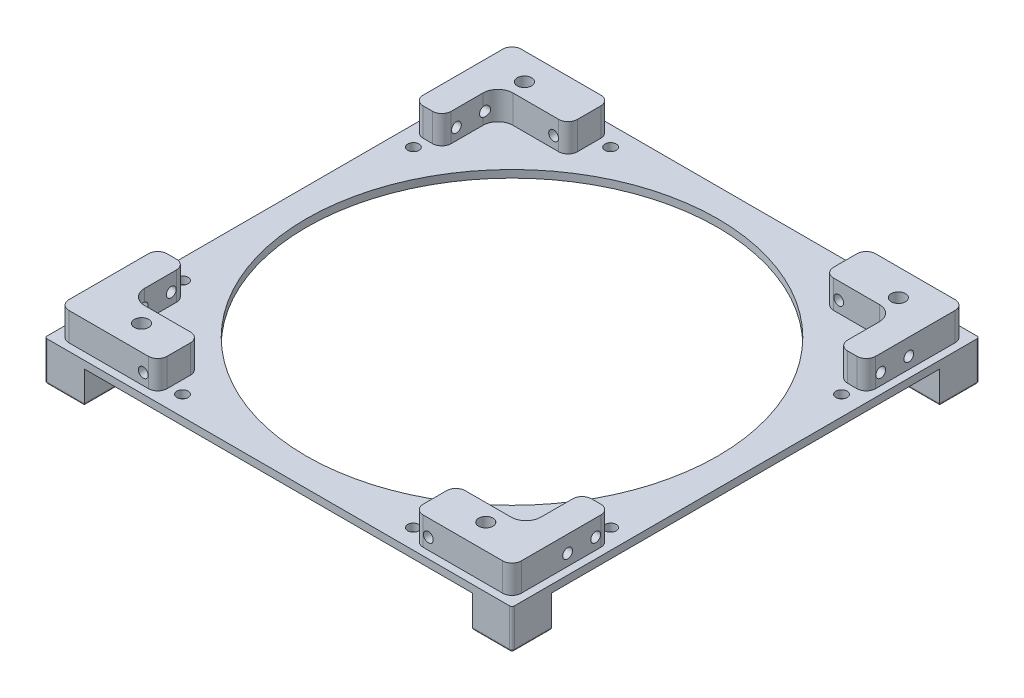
SolidWorks part; units mm, degrees
ref_plane "Front Plane" through (0, 0, 0) normal (0, 0, 1) x (1, 0, 0)
ref_plane "Top Plane" through (0, 0, 0) normal (0, 1, 0) x (1, 0, 0)
ref_plane "Right Plane" through (0, 0, 0) normal (1, 0, 0) x (0, 0, -1)
sketch "Sketch2" plane through (0, 0, 0) normal (0, 1, 0) x (1, 0, 0)
  line L1 (-50, 50) -> (50, 50)
  line L2 (-50, 50) -> (-50, -50)
  line L3 (-50, -50) -> (50, -50)
  line L4 (50, 50) -> (50, -50)
  point P4 (0, 50)
  point P6 (-50, 0)
  dimension "D1" = 100
  dimension "D2" = 100
extrude "Boss-Extrude1" add sketch "Sketch2" along normal blind 1.6
sketch "Sketch3" plane through (0, 0, 0) normal (0, 1, 0) x (1, 0, 0)
  line L1 (-50, 50) -> (-41.5, 50)
  line L2 (-50, 50) -> (-50, 41.5)
  line L3 (-50, 41.5) -> (-41.5, 41.5)
  line L4 (-41.5, 50) -> (-41.5, 41.5)
  line L5 (50, 50) -> (41.5, 50)
  line L6 (50, 50) -> (50, 41.5)
  line L7 (50, 41.5) -> (41.5, 41.5)
  line L8 (41.5, 50) -> (41.5, 41.5)
  line L9 (-50, -50) -> (-41.5, -50)
  line L10 (-50, -50) -> (-50, -41.5)
  line L11 (-50, -41.5) -> (-41.5, -41.5)
  line L12 (-41.5, -50) -> (-41.5, -41.5)
  line L13 (50, -50) -> (41.5, -50)
  line L14 (50, -50) -> (50, -41.5)
  line L15 (50, -41.5) -> (41.5, -41.5)
  line L16 (41.5, -50) -> (41.5, -41.5)
  dimension "D1" = 8.5
extrude "Boss-Extrude2" add sketch "Sketch3" against normal blind 6.9
sketch "Sketch4" plane through (0, 0, 0) normal (0, -1, 0) x (1, 0, 0)
  line L0 (27.4, 48.4) -> (48.4, 48.4)
  line L3 (45.4, 45.4) -> (27.4, 45.4)
  line L4 (27.4, 48.4) -> (27.4, 45.4)
  line L7 (48.4, 27.4) -> (45.4, 27.4)
  line L8 (45.4, 45.4) -> (45.4, 27.4)
  line L9 (48.4, 48.4) -> (48.4, 27.4)
  line L10 (50, 41.5) -> (50, -41.5) construction
  line L11 (-41.5, 50) -> (41.5, 50) construction
  line L12 (48.4, -48.4) -> (27.4, -48.4)
  line L13 (48.4, -27.4) -> (45.4, -27.4)
  line L14 (48.4, -27.4) -> (48.4, -48.4)
  line L16 (45.4, -27.4) -> (45.4, -45.4)
  line L19 (45.4, -45.4) -> (27.4, -45.4)
  line L20 (27.4, -48.4) -> (27.4, -45.4)
  line L21 (41.5, -50) -> (-41.5, -50) construction
  dimension "D1" = 21
  dimension "D2" = 3
  dimension "D3" = 1.6
  dimension "D4" = 1.6
  dimension "D5" = 1.6
extrude "Boss-Extrude3" add sketch "Sketch4" against normal blind 7.6
sketch "Sketch51" plane through (0, 0, 0) normal (0, 1, 0) x (1, 0, 0)
  circle A0 centre (0, 0) radius 44
  dimension "D1" = 88
extrude "Cut-Extrude1" cut sketch "Sketch51" along normal up to surface (1.6 mm away)
fillet "Fillet1" radius 2 2 edges at (48.4, 4.6, -48.4) (48.4, 4.6, 48.4)
fillet "Fillet2" radius 0.5 4 edges at (-50, -2.65, 50) (-50, -2.65, -50) (50, -2.65, -50) (50, -2.65, 50)
mirror "Mirror1" about plane through (0, 0, 0) normal (1, 0, 0) of "Boss-Extrude3", "Fillet1"
sketch "Sketch53" plane through (0, 0, 0) normal (0, -1, 0) x (1, 0, 0)
  line L84 (45.4, -45.4) -> (27.4, -45.4)
  line L85 (27.4, 45.4) -> (45.4, 45.4)
  line L86 (27.4, 45.4) -> (27.4, 39.4)
  line L87 (27.4, 39.4) -> (42.4, 39.4)
  line L89 (45.4, 45.4) -> (45.4, 27.4)
  line L90 (45.4, 27.4) -> (42.4, 27.4)
  line L93 (42.4, 27.4) -> (42.4, 39.4)
  line L94 (-27.4, -45.4) -> (-45.4, -45.4)
  line L95 (-27.4, 45.4) -> (-45.4, 45.4)
  line L96 (-27.4, 45.4) -> (-27.4, 39.4)
  line L97 (-27.4, 39.4) -> (-42.4, 39.4)
  line L99 (-45.4, 45.4) -> (-45.4, 27.4)
  line L100 (-45.4, 27.4) -> (-42.4, 27.4)
  line L103 (-42.4, 27.4) -> (-42.4, 39.4)
  line L105 (45.4, -27.4) -> (42.4, -27.4)
  line L106 (45.4, -27.4) -> (45.4, -45.4)
  line L108 (42.4, -27.4) -> (42.4, -39.4)
  line L111 (27.4, -45.4) -> (27.4, -39.4)
  line L112 (27.4, -39.4) -> (42.4, -39.4)
  line L114 (-45.4, -27.4) -> (-42.4, -27.4)
  line L115 (-45.4, -27.4) -> (-45.4, -45.4)
  line L117 (-42.4, -27.4) -> (-42.4, -39.4)
  line L120 (-27.4, -45.4) -> (-27.4, -39.4)
  line L121 (-27.4, -39.4) -> (-42.4, -39.4)
  dimension "D1" = 6
  dimension "D2" = 3
  dimension "D3" = 6
  dimension "D4" = 3
extrude "Boss-Extrude4" add sketch "Sketch53" against normal up to surface (7.6 mm away)
fillet "Fillet3" radius 2 16 edges at (-48.4, 4.6, 27.4) (-48.4, 4.6, -27.4) (48.4, 4.6, 27.4) (48.4, 4.6, -27.4) (27.4, 4.6, -48.4) (27.4, 4.6, 48.4) (-27.4, 4.6, 48.4) (-27.4, 4.6, -48.4) (27.4, 4.6, -39.4) (42.4, 4.6, -27.4) (-27.4, 4.6, -39.4) (-42.4, 4.6, -27.4) (-42.4, 4.6, 27.4) (-27.4, 4.6, 39.4) (42.4, 4.6, 27.4) (27.4, 4.6, 39.4)
sketch "Sketch52" plane through (0, 0, 0) normal (0, 1, 0) x (1, 0, 0)
  line L0 (48.4, -27.4) -> (48.4, -46.4) construction
  line L2 (48.4, -29.4) -> (48.4, -46.4) construction
  line L3 (46.4, -48.4) -> (27.4, -48.4) construction
  line L4 (48.4, 46.4) -> (48.4, 27.4) construction
  line L5 (48.4, 46.4) -> (48.4, 29.4) construction
  point P0 (39.975, 42.685)
  point P1 (-40.035, 42.685)
  point P2 (-36.225, -43.045)
  point P3 (37.435, -43.045)
hole_wizard "CSK for #3 Flat Head Machine Screw1" positions "Sketch60" profile "Sketch61" countersink size "#3" standard "ANSI Inch"
sketch "Sketch60" plane through (0, 0, 0) normal (0, -1, 0) x (-1, 0, 0)
  point P0 (-39.975, 42.685)
  point P3 (40.035, 42.685)
  point P6 (36.225, -43.045)
  point P9 (-37.435, -43.045)
sketch "Sketch61" plane through (39.975, 0, -42.685) normal (1, 0, 0) x (0, 0, -1)
  line L0 (0, 0) -> (0, 8.5157)
  line L1 (0, 8.5157) -> (1.524, 7.6)
  line L2 (1.524, 7.6) -> (1.524, 1.1542)
  line L3 (1.524, 1.1542) -> (2.5273, 0)
  line L5 (2.5273, 0) -> (0, 0)
  line L6 (-1.524, 1.1542) -> (-2.5273, 0) construction
  line L10 (0, 8.5157) -> (-1.524, 7.6) construction
  line L11 (0, -6.35) -> (0, 107.95) construction
  dimension "Hole Dia." = 3.048
  dimension "Hole Depth" = 7.6
  dimension "Near C'Sink Dia." = 5.0546
  dimension "Near C'Sink Angle" = 82
  dimension "Drill Angle" = 118
sketch "Sketch62" plane through (0, 0, 0) normal (0, -1, 0) x (1, 0, 0)
  circle A0 centre (-40.035, -42.685) radius 2.5273
  circle A1 centre (39.975, -42.685) radius 2.5273
  arc A2 (-41.5, -44.7444) -> (-42.2673, -41.5) centre (-40.035, -42.685) ccw construction
  arc A3 (42.2073, -41.5) -> (41.5, -44.7003) centre (39.975, -42.685) ccw construction
extrude "Cut-Extrude2" cut sketch "Sketch62" along normal up to surface (6.9 mm away)
fillet "Fillet5" radius 0.5 26 edges at (-41.5, -6.9, -47.3722) (-45.5, -6.9, -50) (-49.8536, -6.9, -49.8536) (-50, -6.9, -45.5) (-46.1336, -6.9, -41.5) (-42.4945, -6.9, -43.2666) (-41.5, -6.9, 45.75) (-45.75, -6.9, 41.5) (-50, -6.9, 45.5) (-49.8536, -6.9, 49.8536) (-45.5, -6.9, 50) (45.75, -6.9, 41.5) (41.5, -6.9, 45.75) (45.5, -6.9, 50) (49.8536, -6.9, 49.8536) (50, -6.9, 45.5) (50, -6.9, -45.5) (49.8536, -6.9, -49.8536) (45.5, -6.9, -50) (41.5, -6.9, -47.3502) (42.4428, -6.9, -43.2304) (46.1036, -6.9, -41.5) (41.5, -3.45, -44.7003) (42.2073, -3.45, -41.5) (-41.5, -3.45, -44.7444) (-42.2673, -3.45, -41.5)
sketch "side-mounting-1-holes" plane through (0, 0, 0) normal (1, 0, 0) x (0, 0, -1)
  line L0 (-49.5, 1.6) -> (49.5, 1.6) construction
  line L1 (50, 0) -> (50, -6.9) construction
  point P0 (36.5, 4.05)
  point P1 (30.5, 4.05)
  dimension "D1" = 2.45
  dimension "D2" = 13.5
  dimension "D3" = 19.5
hole_wizard "M2 Helicoil insert-1" positions "Sketch48" profile "Sketch50" hole size "M2.2x0.45" standard "ANSI Metric"
sketch "Sketch48" plane through (48.4, 0, 0) normal (1, 0, 0) x (0, 0, -1)
  point P0 (36.5, 4.05)
  point P3 (30.5, 4.05)
sketch "Sketch50" plane through (48.4, 4.05, -36.5) normal (0, 1, 0) x (0, 0, -1)
  line L0 (0, 0) -> (0, 6)
  line L1 (0, 6) -> (1.05, 6)
  line L2 (1.05, 6) -> (1.05, 0)
  line L5 (1.05, 0) -> (0, 0)
  line L11 (0, -6.35) -> (0, 107.95) construction
  dimension "Thru Hole Dia." = 2.1
  dimension "Thru Hole Depth" = 6
sketch "side-mounting-2-holes" plane through (0, 0, 0) normal (0, 0, 1) x (1, 0, 0)
  line L0 (50, 0) -> (50, -6.9) construction
  line L2 (29.4, 1.6) -> (46.4, 1.6) construction
  point P1 (30.5, 4.05)
  dimension "D1" = 2.45
  dimension "D2" = 19.5
hole_wizard "M2 Helicoil insert-2" positions "Sketch44" profile "Sketch46" hole size "M2.2x0.45" standard "ANSI Metric"
sketch "Sketch44" plane through (0, 0, -48.4) normal (0, 0, -1) x (-1, 0, 0)
  point P0 (-30.5, 4.05)
sketch "Sketch46" plane through (30.5, 4.05, -48.4) normal (1, 0, 0) x (0, 1, 0)
  line L0 (0, 0) -> (0, 9)
  line L1 (0, 9) -> (1.05, 9)
  line L2 (1.05, 9) -> (1.05, 0)
  line L5 (1.05, 0) -> (0, 0)
  line L11 (0, -6.35) -> (0, 107.95) construction
  dimension "Thru Hole Dia." = 2.1
  dimension "Thru Hole Depth" = 9
mirror "Mirror4" about plane through (0, 0, 0) normal (1, 0, 0) of "M2 Helicoil insert-2", "M2 Helicoil insert-1"
mirror "Mirror5" about plane through (0, 0, 0) normal (0, 0, 1) of "Mirror4", "M2 Helicoil insert-1", "M2 Helicoil insert-2"
sketch "antenna-board-mounting-holes" plane through (0, 0, 0) normal (0, -1, 0) x (1, 0, 0)
  line L0 (-50, -41.5) -> (-50, 41.5) construction
  line L1 (41.5, -50) -> (-41.5, -50) construction
  point P0 (-45.8, -24.7)
  point P1 (-24.7, -45.8)
  dimension "D1" = 4.2
  dimension "D2" = 4.2
  dimension "D3" = 25.3
  dimension "D4" = 25.3
hole_wizard "M2 Clearance Hole1" positions "Sketch57" profile "Sketch58" hole size "M2" standard "ANSI Metric"
sketch "Sketch57" plane through (0, 1.6, 0) normal (0, 1, 0) x (1, 0, 0)
  point P0 (-45.8, 24.7)
  point P3 (-24.7, 45.8)
sketch "Sketch58" plane through (-45.8, 1.6, -24.7) normal (1, 0, 0) x (0, 0, 1)
  line L0 (0, 0) -> (0, 1.6)
  line L1 (0, 1.6) -> (1.2, 1.6)
  line L2 (1.2, 1.6) -> (1.2, 0)
  line L5 (1.2, 0) -> (0, 0)
  line L11 (0, -6.35) -> (0, 107.95) construction
  dimension "Thru Hole Dia." = 2.4
  dimension "Thru Hole Depth" = 1.6
mirror "Mirror6" about plane through (0, 0, 0) normal (1, 0, 0) of "M2 Clearance Hole1"
mirror "Mirror7" about plane through (0, 0, 0) normal (0, 0, 1) of "Mirror6", "M2 Clearance Hole1"
fillet "Fillet4" radius 3.2 4 edges at (-42.4, 4.6, 39.4) (42.4, 4.6, 39.4) (42.4, 4.6, -39.4) (-42.4, 4.6, -39.4)
equation "\"D1@Sketch52\"=7.65+3.315"
equation "\"D2@Sketch52\"=\"D1@Sketch52\"+73.66"
equation "\"D3@Sketch52\"=0.665+4.69"
equation "\"D4@Sketch52\"=\"D3@Sketch52\"+85.73"
equation "\"D5@Sketch52\"=5.11+3.315"
equation "\"D6@Sketch52\"=\"D5@Sketch52\"+80.01"
equation "\"D1@Boss-Extrude3\"=6.00+1.6mm"
equation "\"D1@Boss-Extrude2\"=8.50-1.6mm"
